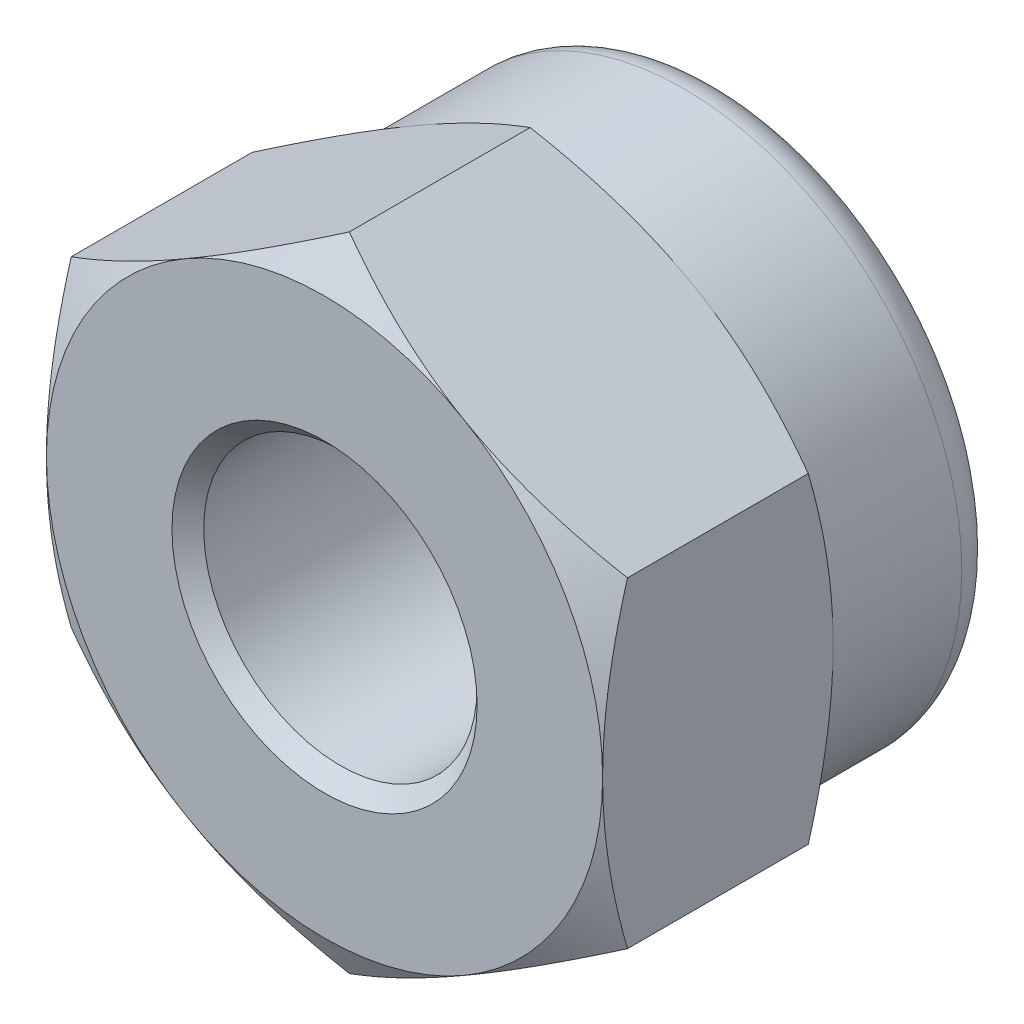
SolidWorks part; units mm, degrees
ref_plane "前视基准面" through (0, 0, 0) normal (0, 0, 1) x (1, 0, 0)
ref_plane "上视基准面" through (0, 0, 0) normal (0, 1, 0) x (1, 0, 0)
ref_plane "右视基准面" through (0, 0, 0) normal (1, 0, 0) x (0, 0, -1)
sketch "草图1" plane through (0, 0, 0) normal (0, 0, 1) x (1, 0, 0)
  line L1 (0, 0) -> (7.66, 0)
  line L2 (0, 0) -> (0, -4)
  line L3 (0, -4) -> (7.66, -4)
  line L4 (7.66, 0) -> (7.66, -4)
  line L5 (0, 0) -> (0.7, 0)
  line L6 (0, 0) -> (0, -2.9)
  line L7 (0, -2.9) -> (0.7, -2.9)
  line L8 (0.7, 0) -> (0.7, -2.9)
  line L9 (0, 0) -> (7, 0)
  line L10 (0, 0) -> (0, -5)
  line L11 (0, -5) -> (7, -5)
  line L12 (7, 0) -> (7, -5)
  dimension "E" = 7.66
  dimension "M" = 4
  dimension "M_" = 2.9
  dimension "P" = 0.7
  dimension "H" = 5
  dimension "S" = 7
sketch "草图7" plane through (0, 0, 0) normal (0, 0, 1) x (1, 0, 0)
  line L1 (0, 4.0415) -> (-3.5, 2.0207)
  line L2 (-3.5, 2.0207) -> (-3.5, -2.0207)
  line L3 (-3.5, -2.0207) -> (0, -4.0415)
  line L4 (0, -4.0415) -> (3.5, -2.0207)
  line L5 (3.5, -2.0207) -> (3.5, 2.0207)
  line L6 (3.5, 2.0207) -> (0, 4.0415)
  circle A0 centre (0, 0) radius 3.5 construction
  circle A1 centre (0, 0) radius 1.72
  dimension "D1" = 3.44
  dimension "D2" = 7
extrude "凸台-拉伸1" add sketch "草图7" against normal blind 2.9
sketch "草图2" plane through (0, 0, 0) normal (1, 0, 0) x (0, 0, -1)
  line L0 (0, 3.5) -> (0.3126, 4.0415)
  line L1 (0, 2.0207) -> (0, 4.0415) construction
  line L2 (2.9, 4.0415) -> (0, 4.0415) construction
  line L3 (0.3126, 4.0415) -> (0, 4.0415)
  line L4 (0, 4.0415) -> (0, 3.5)
  line L5 (0, 0) -> (2.9, 0) construction
  line L6 (2.9, -2.0207) -> (2.9, 2.0207) construction
  line L7 (2.9, 3.5) -> (2.5874, 4.0415)
  line L8 (2.9, 2.0207) -> (2.9, 4.0415) construction
  line L9 (2.5874, 4.0415) -> (2.9, 4.0415)
  line L10 (2.9, 4.0415) -> (2.9, 3.5)
  dimension "D1" = 7
  dimension "D2" = 30
revolve "切除-旋转1" cut sketch "草图2" angle 360 about L5
chamfer "倒角1" [suppressed] distance 0.2 angle 45
sketch "草图3" [suppressed] plane through (0, 0, 0) normal (0, 0, 1) x (1, 0, 0)
  circle A0 centre (0, 0) radius 2.4
  circle A1 centre (0, 0) radius 3.5
  dimension "D1" = 4.8
extrude "凸台-拉伸2" [suppressed] add sketch "草图3" along normal blind 2.1
fillet "圆角1" [suppressed] radius 0.2
sketch "草图4" [suppressed] plane through (0, 0, 0) normal (0, 0, 1) x (1, 0, 0)
  line L0 (-1.72, 0) -> (-1.9596, 0)
  line L1 (-0.86, 1.4896) -> (-0.9798, 1.6971)
  arc A0 (-1.9596, 0) -> (-2.3515, 0.48) centre (-1.9596, 0.4) cw
  arc A1 (-1.5914, 1.7965) -> (-0.9798, 1.6971) centre (-1.3262, 1.4971) cw
  circle A3 centre (0, 0) radius 2.4 construction
  arc A4 (-1.5914, 1.7965) -> (-2.3515, 0.48) centre (0, 0) ccw
  arc A5 (-0.86, 1.4896) -> (-1.72, 0) centre (0, 0) ccw
  point P4 (-2.4, 0)
  dimension "D1" = 3.44
  dimension "D3" = 0.4
  dimension "D2" = 60
extrude "凸台-拉伸3" [suppressed] add sketch "草图4" along normal blind 1.05
pattern_circular "阵列(圆周)1" [suppressed] count 3 over 360
sketch "草图5" plane through (0, 0, -2.9) normal (0, 0, -1) x (-1, 0, 0)
  circle A0 centre (0, 0) radius 3.5
  circle A2 centre (0, 0) radius 2.2
  dimension "D1" = 4.4
extrude "凸台-拉伸4" add sketch "草图5" along normal blind 2.1
fillet "圆角2" radius 0.48 1 edges at (-3.5, 0, -5)
sketch "草图6" plane through (0, 0, -5) normal (0, 0, -1) x (-1, 0, 0)
  circle A0 centre (0, 0) radius 2.625
  dimension "D1" = 5.25
extrude "切除-拉伸1" cut sketch "草图6" against normal blind 0.525
fillet "圆角3" radius 0.1 1 edges at (-2.625, 0, -5)
chamfer "倒角2" distance 0.2 angle 45 2 edges at (1.72, 0, 0) (1.72, 0, -2.9)
